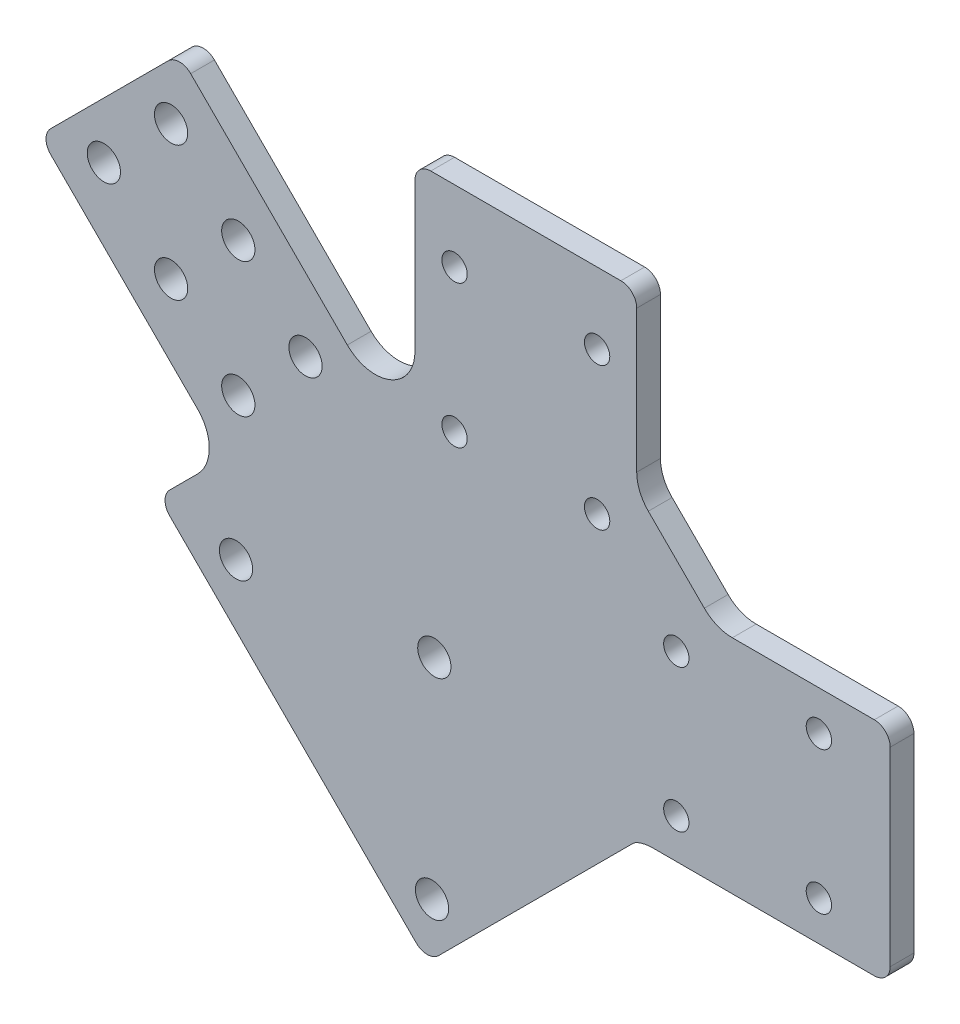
SolidWorks part; units mm, degrees
ref_plane "前视基准面" through (0, 0, 0) normal (0, 0, 1) x (1, 0, 0)
ref_plane "上视基准面" through (0, 0, 0) normal (0, 1, 0) x (1, 0, 0)
ref_plane "右视基准面" through (0, 0, 0) normal (1, 0, 0) x (0, 0, -1)
sketch "草图1" plane through (0, 0, 0) normal (0, 0, 1) x (1, 0, 0)
  line L0 (0, 0) -> (0, 60)
  line L1 (0, 0) -> (60, 0)
  line L2 (0, 60) -> (28, 60)
  line L3 (28, 60) -> (28, 28)
  line L4 (28, 28) -> (60, 28)
  line L5 (60, 28) -> (60, 0)
  line L6 (14, 60) -> (14, 42) construction
  line L7 (60, 14) -> (42, 14) construction
  line L8 (5, 51) -> (23, 51) construction
  line L9 (5, 51) -> (5, 33) construction
  line L10 (5, 33) -> (23, 33) construction
  line L11 (23, 51) -> (23, 33) construction
  line L12 (5, 51) -> (23, 33) construction
  line L13 (5, 33) -> (23, 51) construction
  line L14 (14, 42) -> (14, 89.6) construction
  line L15 (33, 23) -> (51, 23) construction
  line L16 (33, 23) -> (33, 5) construction
  line L17 (33, 5) -> (51, 5) construction
  line L18 (51, 23) -> (51, 5) construction
  line L19 (33, 23) -> (51, 5) construction
  line L20 (33, 5) -> (51, 23) construction
  line L21 (14, 89.6) -> (89.6, 89.6) construction
  line L22 (89.6, 89.6) -> (89.6, 14) construction
  line L23 (89.6, 14) -> (42, 14) construction
  circle A0 centre (23, 51) radius 1.6
  circle A1 centre (5, 51) radius 1.6
  circle A2 centre (23, 33) radius 1.6
  circle A3 centre (5, 33) radius 1.6
  circle A4 centre (51, 23) radius 1.6
  circle A5 centre (51, 5) radius 1.6
  circle A6 centre (33, 5) radius 1.6
  circle A7 centre (33, 23) radius 1.6
  dimension "D5" = 3.2
  dimension "D8" = 3.2
  dimension "D1" = 28
  dimension "D2" = 28
  dimension "D3" = 9
  dimension "D4" = 18
  dimension "D6" = 9
  dimension "D7" = 18
  dimension "D9" = 60
  dimension "D10" = 47.6
extrude "凸台-拉伸1" add sketch "草图1" along normal blind 3
chamfer "倒角1" distance 10 angle 45 1 edges at (28, 28, 1.5)
sketch "草图2" plane through (0, 0, 3) normal (0, 0, 1) x (1, 0, 0)
  line L0 (89.6, 89.6) -> (-4.0916, -4.0916) construction
  line L1 (-4.0916, -4.0916) -> (-47.4019, 39.2186)
  line L2 (-4.0916, -4.0916) -> (13.586, 13.586) construction
  line L3 (13.586, 13.586) -> (-29.7243, 56.8963)
  line L4 (4.7472, 4.7472) -> (-38.5631, 48.0575) construction
  line L5 (-13.8144, 31.794) -> (-22.2996, 23.3087) construction
  line L6 (-22.2996, 40.2793) -> (-30.7849, 31.794) construction
  line L7 (-30.7849, 48.7646) -> (-39.2702, 40.2793) construction
  line L8 (-47.4019, 39.2186) -> (-29.7243, 56.8963)
  line L9 (13.586, 13.586) -> (27.7282, -0.5561)
  line L10 (27.7282, -0.5561) -> (10.0505, -18.2338)
  line L11 (10.0505, -18.2338) -> (-4.0916, -4.0916)
  circle A0 centre (-22.2996, 23.3087) radius 2.1
  circle A1 centre (-13.8144, 31.794) radius 2.1
  circle A2 centre (-39.2702, 40.2793) radius 2.1
  circle A3 centre (-30.7849, 31.794) radius 2.1
  circle A4 centre (-22.2996, 40.2793) radius 2.1
  circle A5 centre (-30.7849, 48.7646) radius 2.1
  point P7 (-4.0916, -4.0916)
  point P13 (-18.057, 27.5514)
  point P18 (-26.5423, 36.0367)
  point P21 (-35.0276, 44.5219)
  point P26 (47.7599, -12.2556)
  dimension "D3" = 4.2
  dimension "D8" = 5
  dimension "D1" = 132.5
  dimension "D2" = 25
  dimension "D4" = 12
  dimension "D5" = 32.25
  dimension "D6" = 12
  dimension "D7" = 12
  dimension "D9" = 20
extrude "凸台-拉伸2" add sketch "草图2" against normal through all
sketch "草图3" plane through (0, 0, 3) normal (0, 0, 1) x (1, 0, 0)
  line L0 (10.0505, -18.2338) -> (1.5652, -26.7191)
  line L1 (1.5652, -26.7191) -> (-32.3759, 7.2221)
  line L2 (-32.3759, 7.2221) -> (-23.8906, 15.7073)
  line L3 (-47.4019, 39.2186) -> (10.0505, -18.2338) construction
  line L4 (10.0505, -18.2338) -> (27.7282, -0.5561) construction
  line L5 (-23.8906, 15.7073) -> (10.0505, -18.2338)
  dimension "D1" = 12
  dimension "D2" = 48
extrude "凸台-拉伸3" add sketch "草图3" against normal through all
sketch "草图4" plane through (0, 0, 0) normal (0, 0, -1) x (-1, 0, 0)
  circle A0 centre (-2.4491, 7.0453) radius 2.1
  circle A1 centre (-2.1618, -19.5375) radius 2.1
  circle A2 centre (22.587, 5.2113) radius 2.1
  dimension "D1" = 4.2
  dimension "D2" = 4.2
extrude "切除-拉伸1" cut sketch "草图4" against normal through all
fillet "圆角1" radius 5 5 edges at (28, 38, 1.5) (38, 28, 1.5) (0, 27.172, 1.5) (27.172, 0, 1.5) (-23.8906, 15.7073, 1.5)
fillet "圆角2" radius 2 9 edges at (60, 28, 1.5) (60, 0, 1.5) (27.7282, -0.5561, 1.5) (1.5652, -26.7191, 1.5) (-32.3759, 7.2221, 1.5) (-47.4019, 39.2186, 1.5) (-29.7243, 56.8963, 1.5) (28, 60, 1.5) (0, 60, 1.5)
